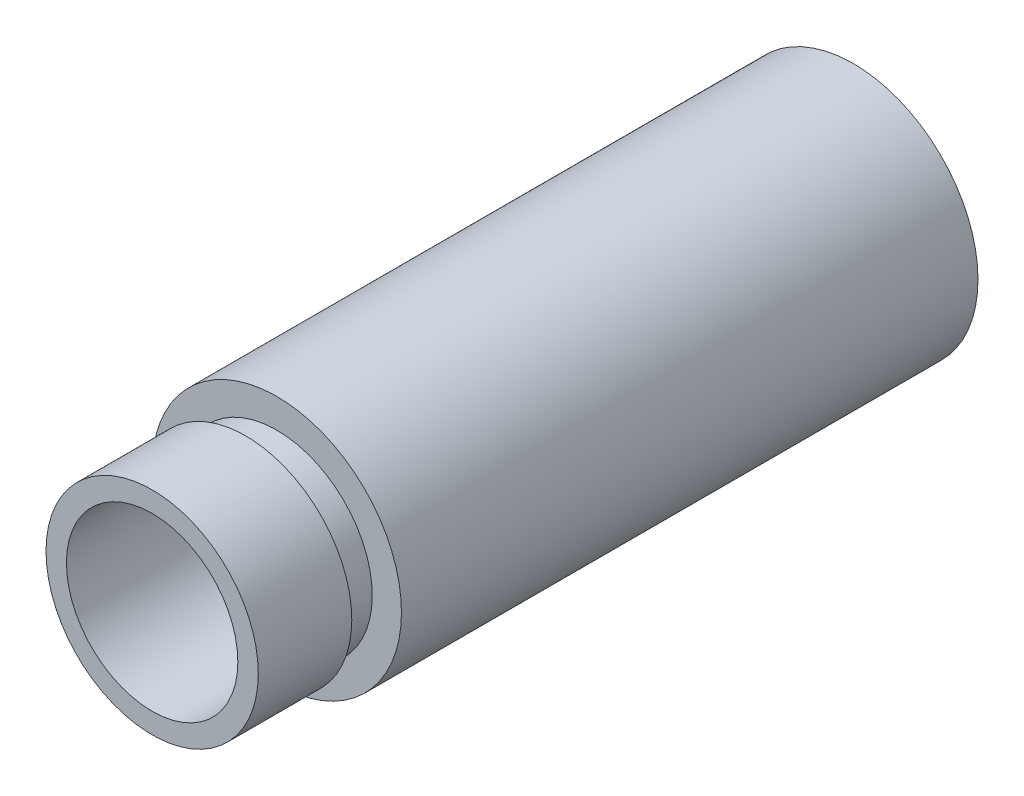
SolidWorks part; units mm, degrees
ref_plane "Face" through (0, 0, 0) normal (0, 0, 1) x (1, 0, 0)
ref_plane "Dessus" through (0, 0, 0) normal (0, 1, 0) x (1, 0, 0)
ref_plane "Droite" through (0, 0, 0) normal (1, 0, 0) x (0, 0, -1)
sketch "Esquisse1" plane through (0, 0, 0) normal (0, 0, 1) x (1, 0, 0)
  circle A0 centre (0, 0) radius 10
  dimension "D1" = 20
extrude "Extrusion1" add sketch "Esquisse1" along normal blind 45
sketch "Esquisse2" plane through (0, 0, 45) normal (0, 0, 1) x (1, 0, 0)
  circle A0 centre (0, 0) radius 5.5
  dimension "D1" = 11
extrude "Enlèv. mat.-Extru.1" cut sketch "Esquisse2" against normal blind 42
sketch "Esquisse3" plane through (0, 0, 3) normal (0, 0, 1) x (1, 0, 0)
  circle A0 centre (0, 0) radius 4
  dimension "D1" = 8
extrude "Enlèv. mat.-Extru.2" cut sketch "Esquisse3" against normal through all
sketch "Esquisse4" plane through (0, 0, 45) normal (0, 0, 1) x (1, 0, 0)
  circle A0 centre (0, 0) radius 8
  dimension "D1" = 16
extrude "Enlèv. mat.-Extru.3" cut sketch "Esquisse4" against normal through all flip side to cut
sketch "Esquisse5" plane through (0, 0, 45) normal (0, 0, 1) x (1, 0, 0)
  circle A0 centre (0, 0) radius 6.8119
  dimension "D1" = 13.6237
extrude "Enlèv. mat.-Extru.4" cut sketch "Esquisse5" against normal blind 6 flip side to cut
sketch "Esquisse6" plane through (0, 0, 39) normal (0, 0, 1) x (1, 0, 0)
  circle A0 centre (0, 0) radius 6.125
  dimension "D1" = 12.25
extrude "Enlèv. mat.-Extru.5" cut sketch "Esquisse6" against normal blind 2 flip side to cut
